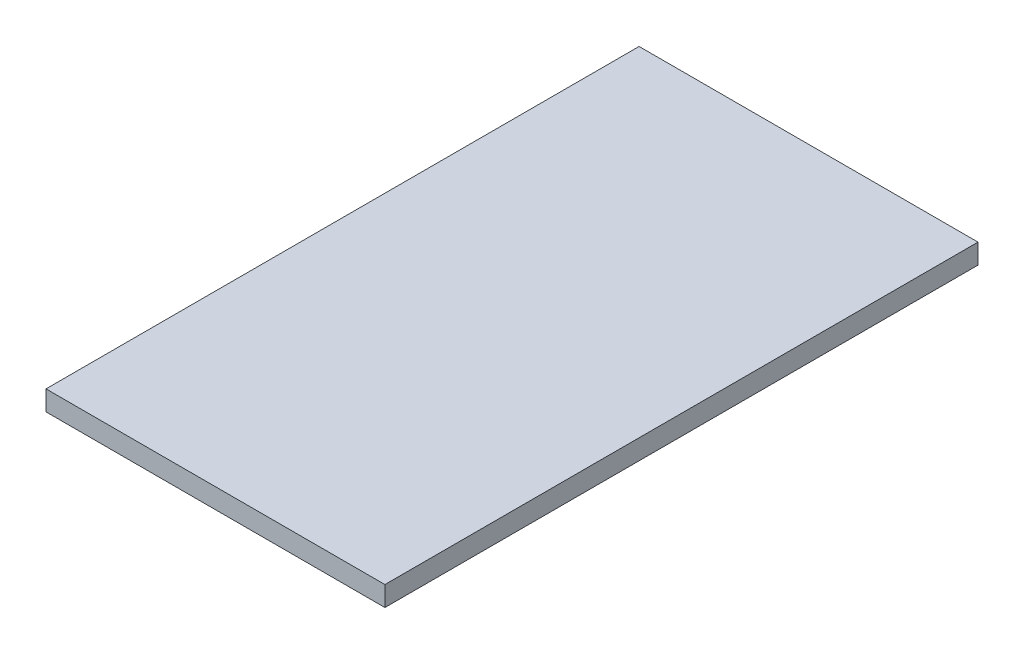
SolidWorks part; units mm, degrees
ref_plane "Plan de face" through (0, 0, 0) normal (0, 0, 1) x (1, 0, 0)
ref_plane "Plan de dessus" through (0, 0, 0) normal (0, 1, 0) x (1, 0, 0)
ref_plane "Plan de droite" through (0, 0, 0) normal (1, 0, 0) x (0, 0, -1)
sketch "Esquisse1" plane through (0, 0, 0) normal (0, 1, 0) x (1, 0, 0)
  line L1 (-340, -595) -> (340, -595)
  line L2 (-340, -595) -> (-340, 595)
  line L3 (-340, 595) -> (340, 595)
  line L4 (340, -595) -> (340, 595)
  line L5 (-340, -595) -> (340, 595) construction
  line L6 (-340, 595) -> (340, -595) construction
  point P0 (0, 0)
  dimension "D1" = 1190
  dimension "D2" = 680
extrude "Boss.-Extru.1" add sketch "Esquisse1" along normal blind 40
